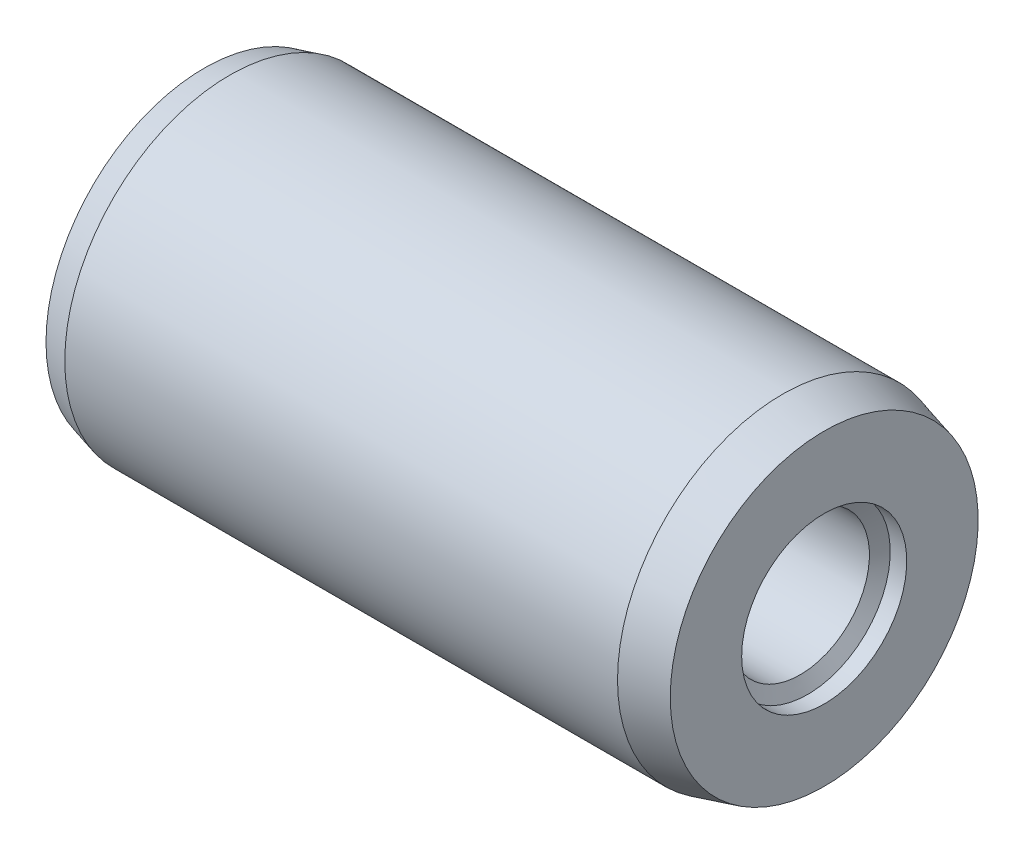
SolidWorks part; units mm, degrees
ref_plane "Plane1" through (0, 0, 0) normal (0, 0, 1) x (1, 0, 0)
ref_plane "Plane2" through (0, 0, 0) normal (0, 1, 0) x (1, 0, 0)
ref_plane "Plane3" through (0, 0, 0) normal (1, 0, 0) x (0, 0, -1)
sketch "Sketch1" plane through (0, 0, 0) normal (0, 0, 1) x (1, 0, 0)
  line L0 (-10, 0) -> (106, 0) construction
  line L1 (0, 0) -> (0, 22.3205)
  line L2 (10, 25) -> (93.7, 25)
  line L3 (100, 23.3119) -> (100, 12.5)
  line L4 (43.691, 0) -> (0, 0)
  line L5 (10, 25) -> (0, 22.3205)
  line L6 (100, 23.3119) -> (93.7, 25)
  line L7 (43.691, 0) -> (50, 10.5)
  line L8 (50, 10.5) -> (96.3453, 10.5)
  line L9 (96.3453, 10.5) -> (97.5, 12.5)
  line L10 (96.3453, -10.5) -> (97.5, -12.5) construction
  line L11 (97.5, 12.5) -> (100, 12.5)
  line L12 (43.691, 0) -> (50, -10.5) construction
  dimension "D1" = 15
  dimension "Length" = 100
  dimension "D2" = 75
  dimension "ChamferLengthA" = 6.3
  dimension "D3" = 120
  dimension "Diameter" = 50
  dimension "CboreDia" = 25
  dimension "D4" = 118
  dimension "CboreDepth" = 2.5
  dimension "TapDrillDepth" = 50
  dimension "TapDrillDia" = 21
  dimension "ChamferLengthC" = 10
revolve "Base-Revolve" add sketch "Sketch1" angle 360 about L0
sketch "Sketch2" plane through (0, 0, 0) normal (0, 0, 1) x (1, 0, 0)
  line L0 (0, 0) -> (26, 0) construction
  line L1 (-10, 0) -> (106, 0) construction
  line L2 (0, 22.3205) -> (0, -22.3205) construction
  line L3 (6.114, 23.9588) -> (6.114, 30)
  line L5 (6.114, 30) -> (-5, 30)
  line L6 (-5, 30) -> (-5, 0)
  line L7 (-5, 0) -> (0, 0)
  line L8 (10, 25) -> (0, 22.3205) construction
  line L9 (93.7, 25) -> (10, 25) construction
  arc A0 (6.114, 23.9588) -> (0, 0) centre (50, 0) ccw
  dimension "D1" = 50
  dimension "D2" = 5
  dimension "D3" = 5
revolve "TypeA" cut sketch "Sketch2" angle 360 about L0
equation "\"D1@Sketch2\" = \"Diameter@Sketch1\""
